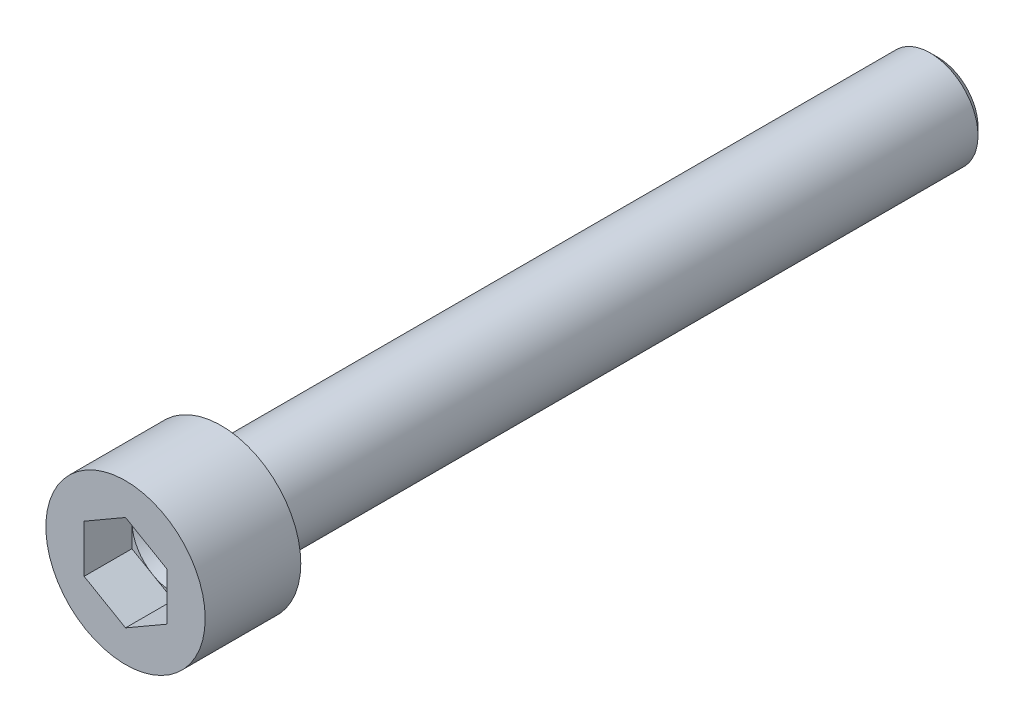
SolidWorks part; units mm, degrees
ref_plane "Face" through (0, 0, 0) normal (0, 0, 1) x (1, 0, 0)
ref_plane "Dessus" through (0, 0, 0) normal (0, 1, 0) x (1, 0, 0)
ref_plane "Droite" through (0, 0, 0) normal (1, 0, 0) x (0, 0, -1)
sketch "Esquisse1" plane through (0, 0, 0) normal (0, 0, 1) x (1, 0, 0)
  circle A0 centre (0, 0) radius 5
  dimension "D1" = 10
extrude "Extrusion2" add sketch "Esquisse1" against normal blind 6
sketch "Esquisse2" plane through (0, 0, -6) normal (0, 0, -1) x (-1, 0, 0)
  circle A0 centre (0, 0) radius 3
  dimension "D1" = 6
extrude "Extrusion3" add sketch "Esquisse2" along normal blind 45
sketch "Esquisse3" plane through (0, 0, 0) normal (0, 0, 1) x (1, 0, 0)
  line L1 (0, -3) -> (2.5981, -1.5)
  line L2 (2.5981, -1.5) -> (2.5981, 1.5)
  line L3 (2.5981, 1.5) -> (0, 3)
  line L4 (0, 3) -> (-2.5981, 1.5)
  line L5 (-2.5981, 1.5) -> (-2.5981, -1.5)
  line L6 (-2.5981, -1.5) -> (0, -3)
  circle A0 centre (0, 0) radius 2.5981 construction
  dimension "D1" = 3
extrude "Enlèv. mat.-Extru.1" cut sketch "Esquisse3" against normal blind 3
sketch "Esquisse4" plane through (0, 0, -3) normal (0, 0, 1) x (1, 0, 0)
  line L0 (2.5981, 1.5) -> (0, 3) construction
  circle A0 centre (0, 0) radius 2.5981
hole_wizard "Trou taraudé 1/16 NPT1" positions "Esquisse3D1" profile "Esquisse5" size "1/16" standard "Ansi Pouce"
sketch3d "Esquisse3D1"
  point P0 (0, 0, 0)
  point P2 (0, 0, -3)
sketch "Esquisse5" plane through (0, 0, -3) normal (1, 0, 0) x (0, -1, 0)
  line L0 (0, 0) -> (0, 1.5624)
  line L1 (2.6, 0.0002) -> (0, 1.5624)
  line L2 (-2.6, 0.0002) -> (0, 1.5624) construction
  line L3 (2.6, 0.0002) -> (2.6, 0.0001)
  line L4 (2.6, 0.0001) -> (3, 0.0001)
  line L5 (3, 0.0001) -> (3, 0)
  line L6 (-3, 0.0001) -> (-3, 0) construction
  line L7 (3, 0) -> (0, 0)
  line L8 (0, -6.35) -> (0, 107.95) construction
  line L11 (-2.6, 0.0001) -> (-3, 0.0001) construction
  dimension "Diamètre du trou pour taraudage" = 5.2
  dimension "Profondeur du trou pour taraudage" = 0.0002
  dimension "Diamètre du filetage" = 6
  dimension "Angle de filetage" = 3.43
  dimension "Profondeur du filetage" = 0.0001
  dimension "Angle de pointe" = 118
chamfer "Chanfrein1" distance 0.5 angle 45
